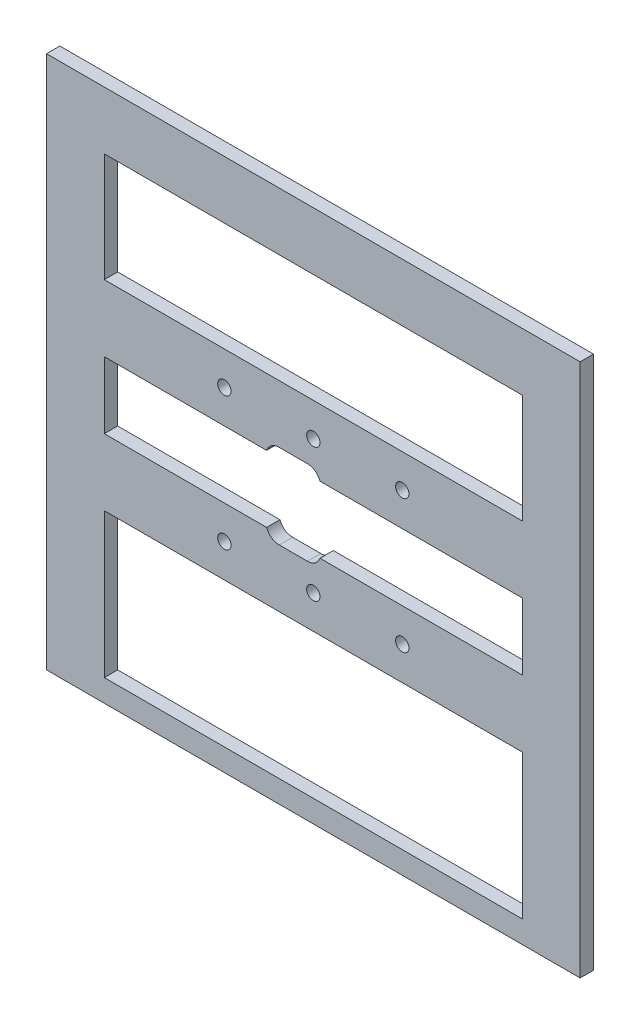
SolidWorks part; units mm, degrees
ref_plane "前视基准面" through (0, 0, 0) normal (0, 0, 1) x (1, 0, 0)
ref_plane "上视基准面" through (0, 0, 0) normal (0, 1, 0) x (1, 0, 0)
ref_plane "右视基准面" through (0, 0, 0) normal (1, 0, 0) x (0, 0, -1)
sketch "草图1" plane through (0, 0, 0) normal (0, 0, 1) x (1, 0, 0)
  line L1 (-60, 60) -> (60, 60)
  line L2 (-60, 60) -> (-60, -60)
  line L3 (-60, -60) -> (60, -60)
  line L4 (60, 60) -> (60, -60)
  line L5 (-60, 60) -> (60, -60) construction
  line L6 (-60, -60) -> (60, 60) construction
  point P0 (0, 0)
  dimension "D1" = 120
  dimension "D2" = 120
extrude "凸台-拉伸1" add sketch "草图1" along normal blind 3
hole_wizard "Ø3.0 (3) 直径孔1" positions "草图4" profile "草图3" hole size "Ø3.0" standard "GB"
sketch "草图4" plane through (0, 0, 3) normal (0, 0, 1) x (1, 0, 0)
  point P0 (-20, 15)
  point P3 (-20, -15)
  point P6 (20, -15)
  point P9 (20, 15)
  dimension "D1" = 40
  dimension "D2" = 40
  dimension "D3" = 30
  dimension "D4" = 30
  dimension "D5" = 15
  dimension "D6" = 20
  dimension "D7" = 20
  dimension "D8" = 15
sketch "草图3" plane through (-20, 15, 3) normal (1, 0, 0) x (0, -1, 0)
  line L0 (0, 0) -> (0, 3)
  line L1 (0, 3) -> (1.5, 3)
  line L2 (1.5, 3) -> (1.5, 0)
  line L5 (1.5, 0) -> (0, 0)
  line L11 (0, -6.35) -> (0, 107.95) construction
  dimension "通孔孔直径" = 3
  dimension "通孔孔深度" = 3
sketch "草图5" plane through (0, 0, 3) normal (0, 0, 1) x (1, 0, 0)
  line L1 (-47, 32.5) -> (47, 32.5)
  line L2 (-47, 32.5) -> (-47, 22.5)
  line L3 (-47, 22.5) -> (47, 22.5)
  line L4 (47, 32.5) -> (47, 22.5)
  line L5 (-47, 7.5) -> (47, 7.5)
  line L6 (-47, 7.5) -> (-47, -7.5)
  line L7 (-47, -7.5) -> (47, -7.5)
  line L8 (47, 7.5) -> (47, -7.5)
  line L9 (-47, 7.5) -> (47, -7.5) construction
  line L10 (-47, -7.5) -> (47, 7.5) construction
  line L11 (-47, -22.5) -> (47, -22.5)
  line L12 (-47, -22.5) -> (-47, -32.5)
  line L13 (-47, -32.5) -> (47, -32.5)
  line L14 (47, -22.5) -> (47, -32.5)
  point P4 (0, 0)
  dimension "D1" = 15
  dimension "D2" = 94
  dimension "D3" = 94
  dimension "D4" = 94
  dimension "D5" = 47
  dimension "D6" = 47
  dimension "D7" = 10
  dimension "D8" = 10
  dimension "D9" = 15
  dimension "D10" = 15
extrude "切除-拉伸1" cut sketch "草图5" against normal blind 3
sketch "草图6" plane through (0, 0, 0) normal (0, 0, -1) x (-1, 0, 0)
  line L0 (47, -7.5) -> (-47, -7.5) construction
  line L1 (10.5, -7.5) -> (-1.5, -7.5)
  line L2 (10.5, -7.5) -> (10.5, -9.5)
  line L3 (10.5, -9.5) -> (-1.5, -9.5)
  line L4 (-1.5, -7.5) -> (-1.5, -9.5)
  line L5 (-47, 7.5) -> (47, 7.5) construction
  line L6 (10.5, 7.5) -> (-1.5, 7.5)
  line L7 (10.5, 7.5) -> (10.5, 9.5)
  line L8 (10.5, 9.5) -> (-1.5, 9.5)
  line L9 (-1.5, 7.5) -> (-1.5, 9.5)
  line L10 (10.5, -7.5) -> (10.5, 7.5) construction
  dimension "D1" = 2
  dimension "D2" = 12
  dimension "D3" = 2
  dimension "D4" = 12
  dimension "D5" = 0
  dimension "D6" = 0
extrude "切除-拉伸2" cut sketch "草图6" against normal blind 3
fillet "圆角1" radius 3 4 edges at (1.5, -9.5, 1.5) (-10.5, -9.5, 1.5) (1.5, 9.5, 1.5) (-10.5, 9.5, 1.5)
sketch "草图7" plane through (0, 0, 0) normal (0, 0, -1) x (-1, 0, 0)
  line L1 (-47, 32.5) -> (47, 32.5)
  line L2 (-47, 32.5) -> (-47, 47)
  line L3 (-47, 47) -> (47, 47)
  line L4 (47, 32.5) -> (47, 47)
  point P5 (42, 42)
extrude "切除-拉伸3" cut sketch "草图7" against normal blind 3
sketch "草图8" plane through (0, 0, 3) normal (0, 0, 1) x (1, 0, 0)
  line L1 (-47, -32.5) -> (47, -32.5)
  line L2 (-47, -32.5) -> (-47, -55)
  line L3 (-47, -55) -> (47, -55)
  line L4 (47, -32.5) -> (47, -55)
  line L6 (-60, -60) -> (60, -60) construction
  line L7 (47, -47) -> (47, 47) construction
  line L8 (-47, 47) -> (-47, -47) construction
  line L9 (-47, -32.5) -> (47, -32.5) construction
  point P5 (47.9165, -55.5654)
  point P7 (47, -50)
  point P11 (-52, -32.9596)
  point P14 (42, -32.5)
  dimension "D1" = 5
  dimension "D2" = 0
extrude "切除-拉伸4" cut sketch "草图8" against normal blind 3
hole_wizard "Ø3.0 (3) 直径孔2" positions "草图9" profile "草图10" hole size "Ø3.0" standard "GB"
sketch "草图9" plane through (0, 0, 3) normal (0, 0, 1) x (1, 0, 0)
  line L0 (47, 7.5) -> (1.5, 7.5) construction
  line L1 (1.5, -7.5) -> (47, -7.5) construction
  point P0 (0, -15)
  point P2 (0, 15)
  point P9 (-3.1236, -15)
  point P10 (0, 0)
  dimension "D1" = 7.5
  dimension "D2" = 7.5
sketch "草图10" plane through (0, -15, 3) normal (1, 0, 0) x (0, -1, 0)
  line L0 (0, 0) -> (0, 3)
  line L1 (0, 3) -> (1.5, 3)
  line L2 (1.5, 3) -> (1.5, 0)
  line L5 (1.5, 0) -> (0, 0)
  line L11 (0, -6.35) -> (0, 107.95) construction
  dimension "通孔孔直径" = 3
  dimension "通孔孔深度" = 3
